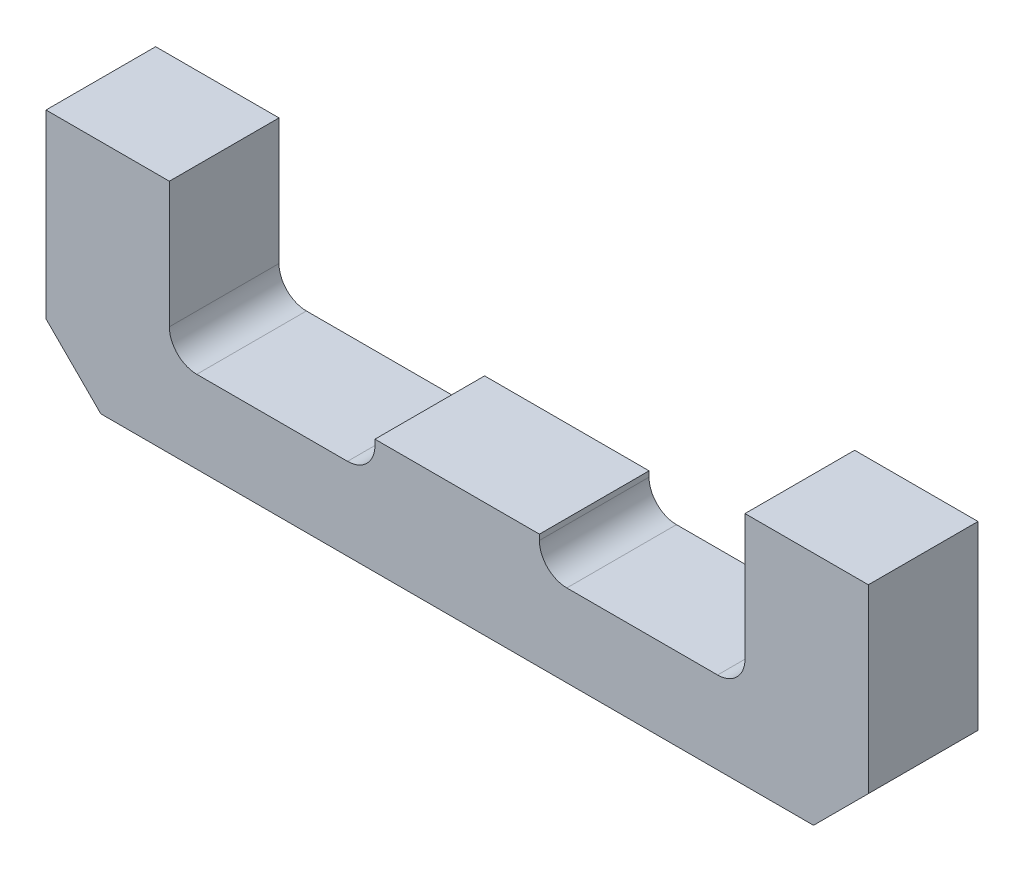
SolidWorks part; units mm, degrees
ref_plane "Face" through (0, 0, 0) normal (0, 0, 1) x (1, 0, 0)
ref_plane "Dessus" through (0, 0, 0) normal (0, 1, 0) x (1, 0, 0)
ref_plane "Droite" through (0, 0, 0) normal (1, 0, 0) x (0, 0, -1)
sketch "Esquisse1" plane through (0, 0, 0) normal (0, 0, 1) x (1, 0, 0)
  line L0 (-15, 0) -> (15, 0)
  line L1 (15, 0) -> (15, -6)
  line L2 (15, -6) -> (52.5, -6)
  line L3 (52.5, -6) -> (52.5, 22)
  line L4 (52.5, 22) -> (75, 22)
  line L5 (75, 22) -> (75, -21)
  line L6 (75, -21) -> (-75, -21)
  line L7 (-75, -21) -> (-75, 22)
  line L8 (-75, 22) -> (-52.5, 22)
  line L9 (-52.5, 22) -> (-52.5, -6)
  line L10 (-52.5, -6) -> (-15, -6)
  line L11 (-15, -6) -> (-15, 0)
  dimension "D1" = 105
  dimension "D2" = 150
  dimension "D3" = 22
  dimension "D4" = 6
  dimension "D5" = 15
  dimension "D6" = 30
extrude "Extrusion1" add sketch "Esquisse1" along normal blind 20
chamfer "Chanfrein1" distance 10 angle 45 2 edges at (75, -21, 10) (-75, -21, 10)
fillet "Congé1" radius 5 4 edges at (15, -6, 10) (52.5, -6, 10) (-52.5, -6, 10) (-15, -6, 10)
